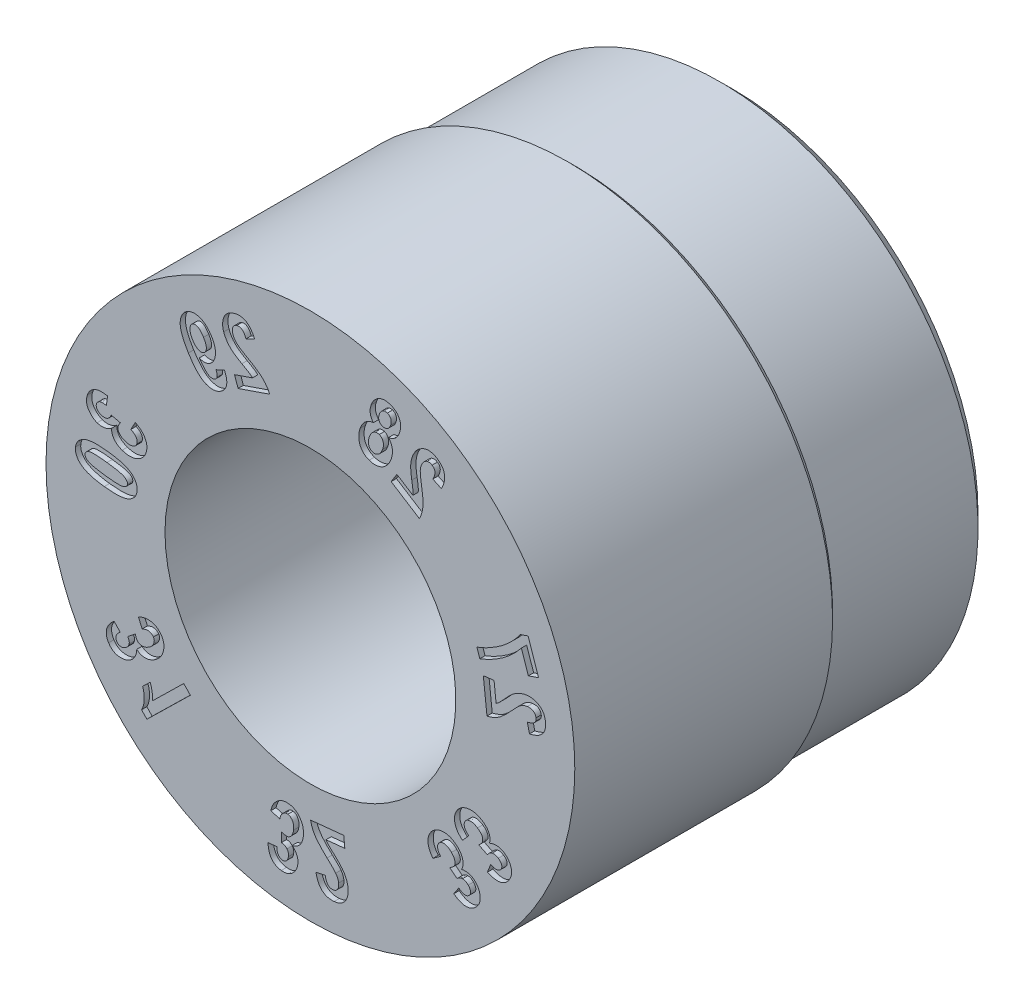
SolidWorks part; units mm, degrees
ref_plane "Front Plane" through (0, 0, 0) normal (0, 0, 1) x (1, 0, 0)
ref_plane "Top Plane" through (0, 0, 0) normal (0, 1, 0) x (1, 0, 0)
ref_plane "Right Plane" through (0, 0, 0) normal (1, 0, 0) x (0, 0, -1)
sketch "Sketch2" plane through (0, 0, 0) normal (0, 1, 0) x (1, 0, 0)
  line L0 (0, 4.8491) -> (0, -49995.1509) construction
  line L10 (9.2496, 16) -> (2, 16)
  line L11 (9.75, 15.4996) -> (9.2496, 16)
  line L12 (9.75, 10) -> (9.75, 15.4996)
  line L13 (10, 9.75) -> (9.75, 10)
  line L14 (10, 0) -> (10, 9.75)
  line L15 (5.5, 0) -> (10, 0)
  line L16 (5.5, 0) -> (5.5, 12)
  line L17 (2, 12) -> (5.5, 12)
  line L18 (2, 12) -> (2, 16)
  dimension "D1" = 20
  dimension "D2" = 11
  dimension "D3" = 4
  dimension "D4" = 4
  dimension "D5" = 19.5
  dimension "D6" = 16
  dimension "D7" = 45
  dimension "D8" = 45
  dimension "D9" = 6
  dimension "D10" = 0.5004
revolve "Revolve1" add sketch "Sketch2" angle 360 about L0
sketch "Sketch9" plane through (0, 0, 0) normal (0, 0, 1) x (1, 0, 0)
  line L0 (0, 0) -> (0, 10) construction
  line L1 (0, 0) -> (7.8183, 6.2349) construction
  line L2 (0, 0) -> (9.7493, -2.2252) construction
  line L3 (0, 0) -> (4.3388, -9.0097) construction
  line L4 (0, 0) -> (-4.3388, -9.0097) construction
  line L5 (0, 0) -> (-9.7493, -2.2252) construction
  line L6 (0, 0) -> (-7.8183, 6.2349) construction
  circle A0 centre (0, 0) radius 10 construction
  circle A30 centre (0, 0) radius 6.6854 construction
  text T0 "27    28    29    30    31    32    33" font "Arial Narrow" height 2.29
  point P12 (0, 0)
  dimension "D1" = 7
extrude "Cut-Extrude3" cut sketch "Sketch9" against normal blind 0.2
